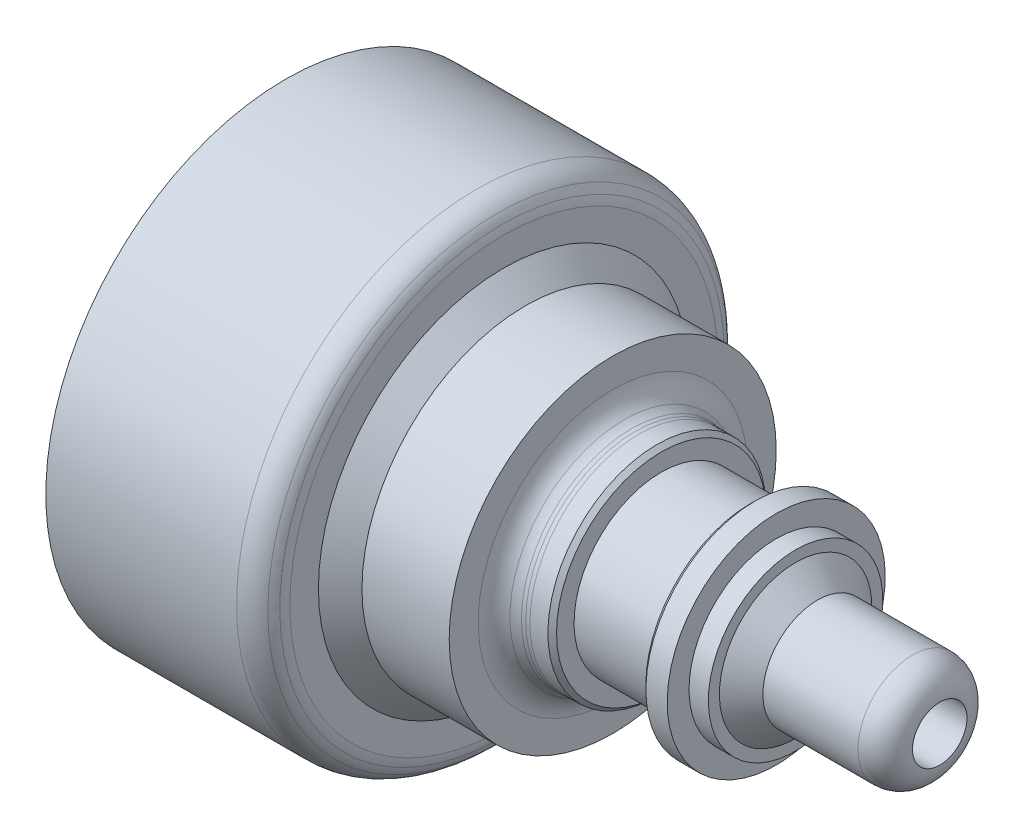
SolidWorks part; units mm, degrees
ref_plane "Front Plane" through (0, 0, 0) normal (0, 0, 1) x (1, 0, 0)
ref_plane "Top Plane" through (0, 0, 0) normal (0, 1, 0) x (1, 0, 0)
ref_plane "Right Plane" through (0, 0, 0) normal (1, 0, 0) x (0, 0, -1)
sketch "Sketch1" plane through (0, 0, 0) normal (0, 0, 1) x (1, 0, 0)
  line L0 (-76.2, 27.94) -> (-76.2, 0)
  line L1 (-76.2, 0) -> (0, 0)
  line L2 (0, 0) -> (0, 3.1666)
  line L3 (-3.175, 6.3501) -> (-14.2545, 6.3501)
  line L4 (-14.2545, 6.3501) -> (-16.7945, 8.8774)
  line L5 (-16.7945, 8.8774) -> (-16.7945, 10.16)
  line L6 (-16.7945, 10.16) -> (-19.05, 10.16)
  line L7 (-19.05, 10.16) -> (-19.05, 12.7)
  line L8 (-19.05, 12.7) -> (-21.5316, 12.7)
  line L9 (-21.5316, 12.7) -> (-22.0396, 12.2046)
  line L10 (-22.0396, 12.2046) -> (-22.0396, 10.16)
  line L11 (-22.0396, 10.16) -> (-32.4434, 10.16)
  line L12 (-32.4434, 10.16) -> (-32.4434, 12.2043)
  line L13 (-32.4434, 12.2043) -> (-32.9514, 12.7)
  line L14 (-32.9514, 12.7) -> (-35.0392, 12.7064)
  line L15 (-38.1, 15.6716) -> (-38.1, 19.05)
  line L16 (-38.1, 19.05) -> (-48.26, 19.05)
  line L17 (-48.26, 19.05) -> (-50.8, 21.5825)
  line L18 (-50.8, 21.5825) -> (-50.8, 24.9134)
  line L19 (-53.975, 27.94) -> (-76.2, 27.94)
  line L20 (-76.2, 0) -> (0, 0) construction
  arc A0 (0, 3.1666) -> (-3.175, 6.3501) centre (-3.1884, 3.1617) ccw
  arc A1 (-35.0392, 12.7064) -> (-35.4764, 12.765) centre (-34.9703, 14.8798) cw
  arc A2 (-35.4764, 12.765) -> (-35.8812, 12.8525) centre (-35.3133, 14.5001) cw
  arc A3 (-35.8812, 12.8525) -> (-36.7731, 13.3008) centre (-34.9787, 15.7595) cw
  arc A4 (-36.7731, 13.3008) -> (-38.1, 15.6716) centre (-34.876, 15.9193) cw
  arc A5 (-50.8, 24.9134) -> (-51.0057, 25.874) centre (-54.6449, 24.5923) ccw
  arc A6 (-51.0057, 25.874) -> (-51.5114, 26.7593) centre (-53.9279, 24.792) ccw
  arc A7 (-51.5114, 26.7593) -> (-53.975, 27.94) centre (-53.9986, 24.7301) ccw
revolve "Revolve1" add sketch "Sketch1" angle 360 about L20
sketch "Sketch4" plane through (0, 0, 0) normal (1, 0, 0) x (0, 0, -1)
  line L1 (0, 0) -> (0, 3.1666)
  line L2 (0, 0) -> (-3.1666, 0)
  circle A0 centre (0, 0) radius 3.1666 construction
sketch "Sketch5" plane through (0, 0, 0) normal (1, 0, 0) x (0, 0, -1)
  circle A0 centre (0, 0) radius 3.175
  dimension "D1" = 6.35
extrude "Cut-Extrude1" cut sketch "Sketch5" against normal blind 12.7
sketch "Sketch6" plane through (-76.2, 0, 0) normal (-1, 0, 0) x (0, 0, 1)
  point P0 (0, 0)
  point P1 (0, 0)
